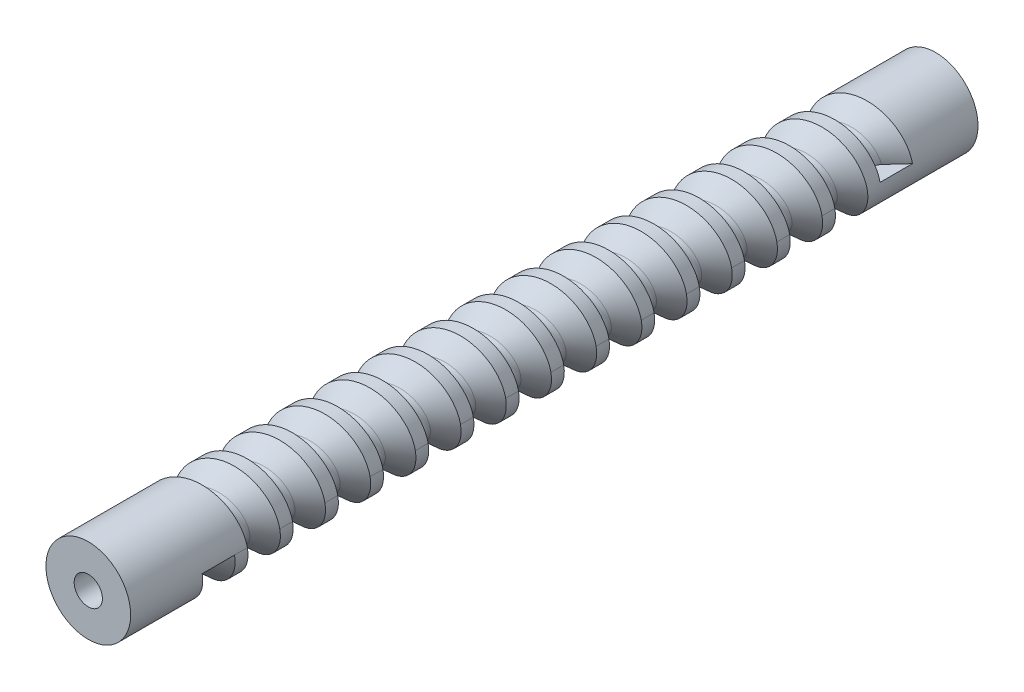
SolidWorks part; units mm, degrees
ref_plane "Front Plane" through (0, 0, 0) normal (0, 0, 1) x (1, 0, 0)
ref_plane "Top Plane" through (0, 0, 0) normal (0, 1, 0) x (1, 0, 0)
ref_plane "Right Plane" through (0, 0, 0) normal (1, 0, 0) x (0, 0, -1)
sketch "Sketch1" plane through (0, 0, 0) normal (0, 0, 1) x (1, 0, 0)
  circle A0 centre (0, 0) radius 15
  dimension "D1" = 30
extrude "Boss-Extrude1" add sketch "Sketch1" along normal blind 300
ref_plane "Plane1" through (0, 0, 270) normal (0, 0, 1) x (1, 0, 0)
sketch "Sketch2" plane through (0, 0, 270) normal (0, 0, 1) x (1, 0, 0)
  circle A1 centre (0, 0) radius 15
  circle A2 centre (0, 0) radius 15
  dimension "D1" = 0
curve "Helix/Spiral1"
sketch "Sketch3" plane through (0, 0, 0) normal (1, 0, 0) x (0, 0, -1)
  line L1 (-257.0706, -16.9576) -> (-264.9299, -9.789)
  line L2 (-269.8819, -11.3629) -> (-272.1605, -21.7535)
  line L3 (-272.1605, -21.7535) -> (-257.0706, -16.9576)
  circle A0 centre (-266, -14.9995) radius 4.5708 construction
  arc A1 (-269.8819, -11.3629) -> (-264.9299, -9.789) centre (-266.9516, -12.0055) cw
  dimension "D1" = 3
sweep "Cut-Sweep1" cut profiles "Sketch3" path "Helix/Spiral1"
sketch "Sketch5" plane through (0, 0, 300) normal (0, 0, 1) x (1, 0, 0)
  circle A0 centre (0, 0) radius 5
  dimension "D1" = 10
extrude "Cut-Extrude2" cut sketch "Sketch5" against normal blind 10
